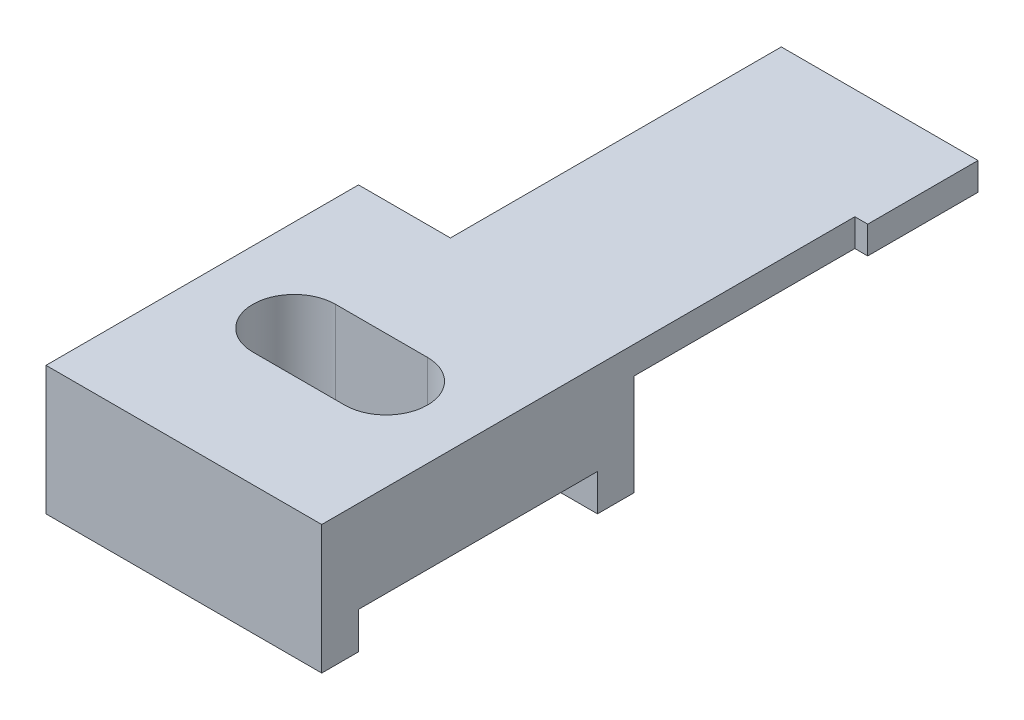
SolidWorks part; units mm, degrees
ref_plane "前视基准面" through (0, 0, 0) normal (0, 0, 1) x (1, 0, 0)
ref_plane "上视基准面" through (0, 0, 0) normal (0, 1, 0) x (1, 0, 0)
ref_plane "右视基准面" through (0, 0, 0) normal (1, 0, 0) x (0, 0, -1)
sketch "草图1" plane through (0, 0, 0) normal (0, 0, 1) x (1, 0, 0)
  line L0 (15.7, 5.5) -> (15.7, 7)
  line L1 (15, 0) -> (15, 5.5)
  line L2 (0, 0) -> (0, 7)
  line L3 (0, 7) -> (15.7, 7)
  line L4 (15, 5.5) -> (15.7, 5.5)
  line L5 (0, 0) -> (15, 0)
extrude "凸台-拉伸1" add sketch "草图1" along normal blind 35
sketch "草图2" plane through (15.7, 0, 0) normal (1, 0, 0) x (0, 0, -1)
  line L0 (-18, 5.5) -> (0, 5.5)
  line L1 (-35, 7) -> (0, 7)
  line L2 (0, 5.5) -> (0, 7)
  line L3 (-35, 0) -> (-35, 7)
  line L4 (-35, 0) -> (-33, 0)
  line L5 (-18, 5.5) -> (-18, 0)
  line L6 (-33, 2) -> (-20, 2)
  line L7 (-33, 0) -> (-33, 2)
  line L8 (-20, 2) -> (-20, 0)
  line L9 (-20, 0) -> (-18, 0)
extrude "切除-拉伸1" cut sketch "草图2" against normal blind 35 flip side to cut
sketch "草图3" plane through (0, 7, 0) normal (0, 1, 0) x (1, 0, 0)
  line L0 (15, -35) -> (15, -6)
  line L1 (5, -18) -> (5, 0)
  line L2 (0, -35) -> (0, -18)
  line L3 (0, -18) -> (5, -18)
  line L4 (0, -35) -> (15, -35)
  line L5 (5, 0) -> (15.7, 0)
  line L6 (15, -6) -> (15.7, -6)
  line L7 (15.7, -6) -> (15.7, 0)
  line L8 (10, -24.25) -> (5, -24.25)
  line L9 (5, -28.75) -> (10, -28.75)
  arc A0 (5, -24.25) -> (5, -28.75) centre (5, -26.5) ccw
  arc A1 (10, -28.75) -> (10, -24.25) centre (10, -26.5) ccw
extrude "切除-拉伸2" cut sketch "草图3" against normal blind 35 flip side to cut
